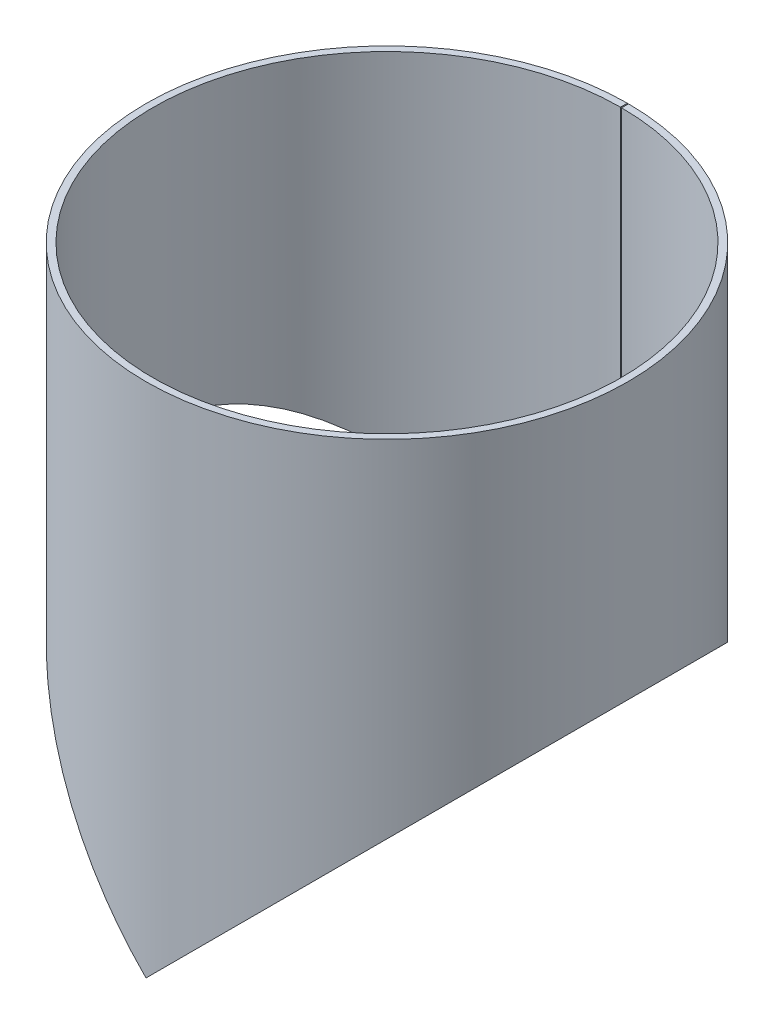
SolidWorks part; units mm, degrees
ref_plane "前视基准面" through (0, 0, 0) normal (0, 0, 1) x (1, 0, 0)
ref_plane "上视基准面" through (0, 0, 0) normal (0, 1, 0) x (1, 0, 0)
ref_plane "右视基准面" through (0, 0, 0) normal (1, 0, 0) x (0, 0, -1)
imported_body "基体零件-等径直交三通管-1"
sheet metal parameters "钣金1" parameters "D1"=0.7366, "厚度"=6
bend "圆角折弯1" bend radius 204 bend angle 359.727 parameters "D5"=1
flatten bends "展开-折弯1"
sketch "尖角-草图1" plane through (-0.5, 225.25, -209.9994) normal (-0.0024, 0, -1) x (-1, 0, 0.0024)
  line L0 (640.3992, 224.75) -> (640.3992, -224.75) construction
  dimension "D1" = 0
process bends "加工-折弯1" parameters "D1"=0
sketch "平面-草图1" plane through (-0.5, 225.25, -209.9994) normal (-0.0024, 0, -1) x (-1, 0, 0.0024)
